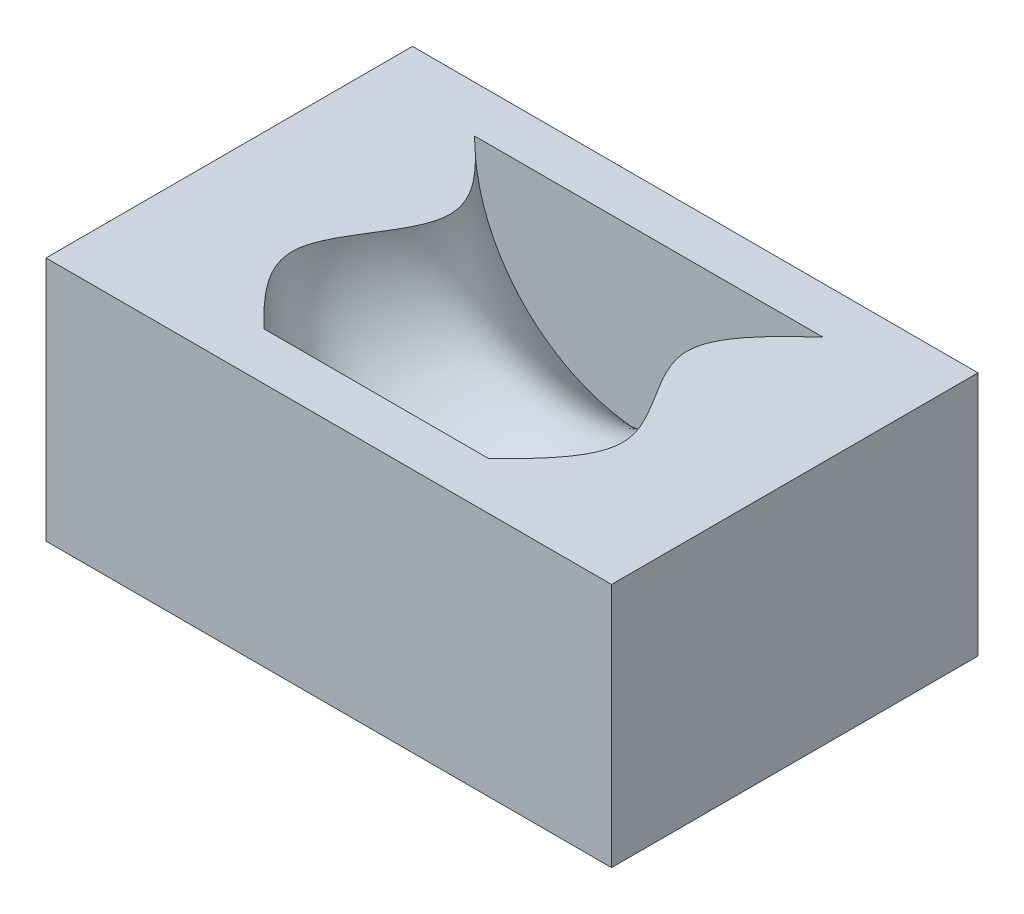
SolidWorks part; units mm, degrees
ref_plane "Front Plane" through (0, 0, 0) normal (0, 0, 1) x (1, 0, 0)
ref_plane "Top Plane" through (0, 0, 0) normal (0, 1, 0) x (1, 0, 0)
ref_plane "Right Plane" through (0, 0, 0) normal (1, 0, 0) x (0, 0, -1)
sketch "Sketch1" plane through (0, 0, 0) normal (0, 1, 0) x (1, 0, 0)
  line L0 (55.8774, -36.2109) -> (-55.8774, 36.2109) construction
  line L1 (-55.8774, 36.2109) -> (55.8774, 36.2109)
  line L2 (-55.8774, 36.2109) -> (-55.8774, -36.2109)
  line L3 (-55.8774, -36.2109) -> (55.8774, -36.2109)
  line L4 (55.8774, 36.2109) -> (55.8774, -36.2109)
extrude "Extrude1" add sketch "Sketch1" along normal blind 48.4691
sketch "Sketch2" plane through (0, 48.4691, 0) normal (0, 1, 0) x (-1, 0, 0)
  line L0 (0, 36.2109) -> (0, -36.2109) construction
  line L1 (55.8774, 36.2109) -> (-55.8774, 36.2109) construction
  line L2 (-55.8774, -36.2109) -> (55.8774, -36.2109) construction
  line L3 (0, -27.0017) -> (-34.4197, -27.0017)
  line L4 (-22.2541, 26.805) -> (0, 26.805)
  line L5 (0, 26.805) -> (0, -27.0017)
  spline S0 degree 3 poles (-34.4197, -27.0017) (-28.7723, -21.729) (-16.6023, -10.3667) (-39.3343, 9.6821) (-27.669, 21.3765) (-22.2541, 26.805) knots 0 0 0 0 0.316909 0.682916 1 1 1 1
revolve "Cut-Revolve1" cut sketch "Sketch2" angle 360 about L0
